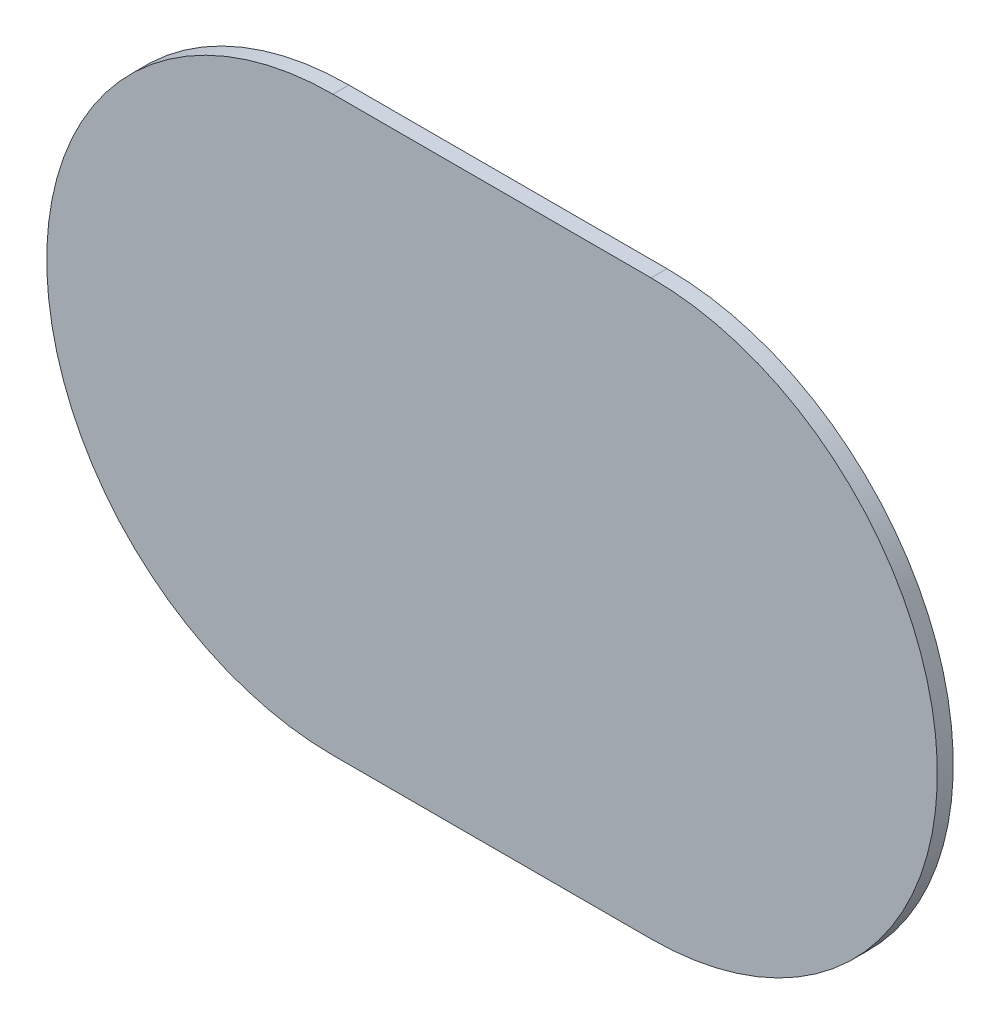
SolidWorks part; units mm, degrees
ref_plane "Front Plane" through (0, 0, 0) normal (0, 0, 1) x (1, 0, 0)
ref_plane "Top Plane" through (0, 0, 0) normal (0, 1, 0) x (1, 0, 0)
ref_plane "Right Plane" through (0, 0, 0) normal (1, 0, 0) x (0, 0, -1)
sketch "Sketch1" plane through (0, 0, 0) normal (0, 0, 1) x (1, 0, 0)
  line L0 (0, 0) -> (10, 0) construction
  line L1 (0, 9) -> (10, 9)
  line L2 (0, -9) -> (10, -9)
  arc A0 (0, 9) -> (0, -9) centre (0, 0) ccw
  arc A1 (10, -9) -> (10, 9) centre (10, 0) ccw
  point P3 (5, 0)
  dimension "D1" = 9
  dimension "D2" = 10
extrude "Boss-Extrude1" add sketch "Sketch1" along normal blind 0.5
